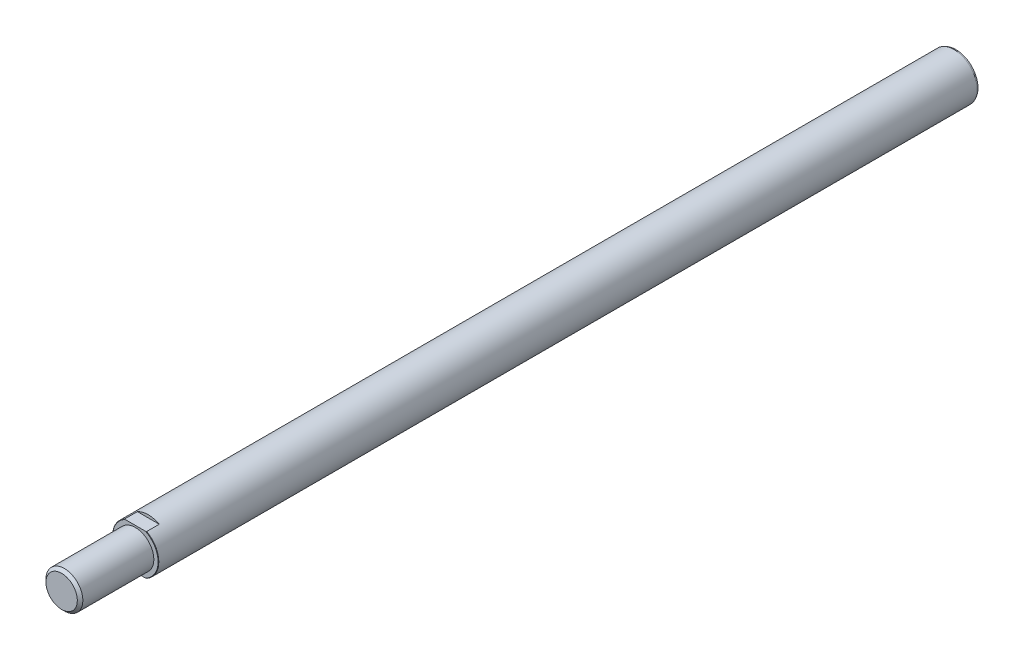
SolidWorks part; units mm, degrees
ref_plane "Plano frontal" through (0, 0, 0) normal (0, 0, 1) x (1, 0, 0)
ref_plane "Plano superior" through (0, 0, 0) normal (0, 1, 0) x (1, 0, 0)
ref_plane "Plano direito" through (0, 0, 0) normal (1, 0, 0) x (0, 0, -1)
sketch "Esboço1" plane through (0, 0, 0) normal (0, 0, 1) x (1, 0, 0)
  circle A0 centre (0, 0) radius 12.5
  dimension "D1" = 25
extrude "Ressalto-extrusão1" add sketch "Esboço1" along normal blind 485
sketch "Esboço2" plane through (0, 0, 485) normal (0, 0, 1) x (1, 0, 0)
  circle A0 centre (0, 0) radius 10
  dimension "D1" = 20
extrude "Corte-extrusão1" cut sketch "Esboço2" against normal blind 40 flip side to cut
chamfer "Chanfro1" distance 0.2 angle 45 1 edges at (12.5, 0, 445)
sketch "Esboço3" plane through (0, 0, 445) normal (0, 0, 1) x (1, 0, 0)
  line L1 (-18.9676, -11) -> (18.9676, -11)
  line L2 (-18.9676, -11) -> (-18.9676, 11)
  line L3 (-18.9676, 11) -> (18.9676, 11)
  line L4 (18.9676, -11) -> (18.9676, 11)
  line L5 (-18.9676, -11) -> (18.9676, 11) construction
  line L6 (-18.9676, 11) -> (18.9676, -11) construction
  point P0 (0, 0)
  dimension "D1" = 22
extrude "Corte-extrusão2" cut sketch "Esboço3" against normal blind 7 flip side to cut
chamfer "Chanfro2" distance 1.5 angle 45 1 edges at (10, 0, 485)
sketch "Esboço4" plane through (0, 0, 0) normal (0, 0, -1) x (-1, 0, 0)
  circle A0 centre (0, 0) radius 12
  dimension "D1" = 24
extrude "Corte-extrusão3" cut sketch "Esboço4" against normal blind 1 flip side to cut
hole_wizard "Furo roscado de M12x1.751" positions "Esboço5" profile "Esboço6" tap size "M12x1.75" standard "Ansi Metric"
sketch "Esboço5" plane through (0, 0, 0) normal (0, 0, -1) x (-1, 0, 0)
  point P0 (0, 0)
sketch "Esboço6" plane through (0, 0, 0) normal (1, 0, 0) x (0, 1, 0)
  line L0 (0, 0) -> (0, 35.8144)
  line L1 (0, 35.8144) -> (5.1, 32.75)
  line L2 (5.1, 32.75) -> (5.1, 0)
  line L5 (5.1, 0) -> (0, 0)
  line L10 (0, 35.8144) -> (-5.1, 32.75) construction
  line L11 (0, -6.35) -> (0, 107.95) construction
  dimension "Tap Drill Dia." = 10.2
  dimension "Tap Drill Depth" = 32.75
  dimension "Drill Angle" = 118
